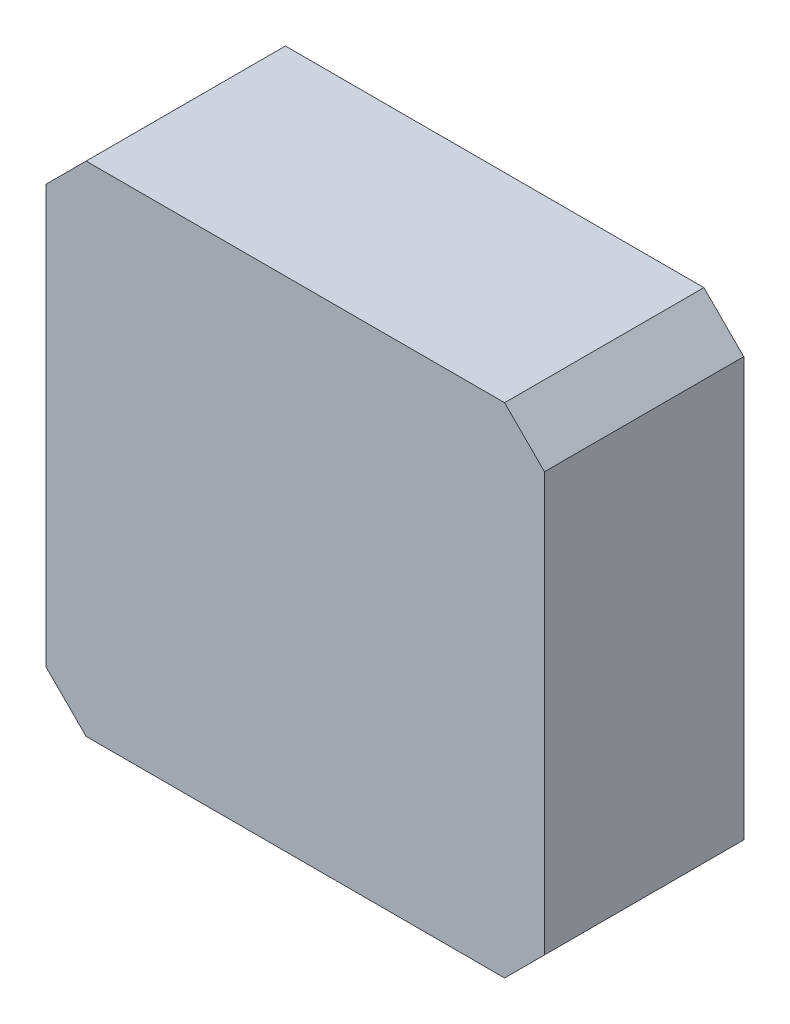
SolidWorks part; units mm, degrees
ref_plane "Front Plane" through (0, 0, 0) normal (0, 0, 1) x (1, 0, 0)
ref_plane "Top Plane" through (0, 0, 0) normal (0, 1, 0) x (1, 0, 0)
ref_plane "Right Plane" through (0, 0, 0) normal (1, 0, 0) x (0, 0, -1)
sketch "Sketch1" plane through (0, 0, 0) normal (0, 0, 1) x (1, 0, 0)
  line L0 (12.5, 25) -> (12.5, 0) construction
  line L1 (0, 0) -> (25, 0)
  line L2 (0, 0) -> (0, 25)
  line L3 (0, 25) -> (25, 25)
  line L4 (25, 0) -> (25, 25)
  line L5 (0, 12.5) -> (25, 12.5) construction
  dimension "D1" = 25
  dimension "D2" = 25
extrude "Extrude1" add sketch "Sketch1" along normal blind 10
chamfer "Chamfer1" distance 2 angle 45 4 edges at (25, 0, 5) (0, 0, 5) (0, 25, 5) (25, 25, 5)
